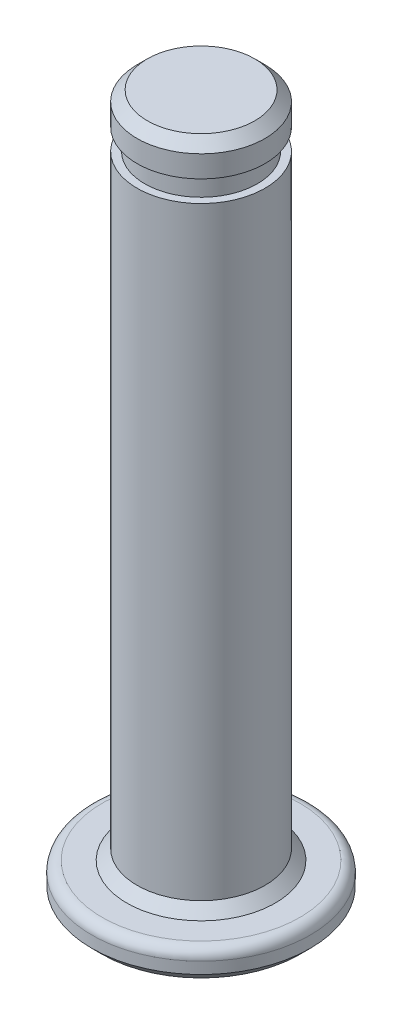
SolidWorks part; units mm, degrees
ref_plane "Front" through (0, 0, 0) normal (0, 0, 1) x (1, 0, 0)
ref_plane "Top" through (0, 0, 0) normal (0, 1, 0) x (1, 0, 0)
ref_plane "Right" through (0, 0, 0) normal (1, 0, 0) x (0, 0, -1)
sketch "Sketch1" plane through (0, 0, 0) normal (0, 0, 1) x (1, 0, 0)
  line L0 (0, 0) -> (0, 126.1546) construction
  line L1 (-4.7625, 89.3482) -> (4.7625, 89.3482)
  line L2 (4.7625, 89.3482) -> (4.7625, 86.9669)
  line L3 (-4.7625, 89.3482) -> (-4.7625, 86.9669)
  line L4 (4.7625, 86.9669) -> (4.191, 86.9669)
  line L5 (-4.7625, 86.9669) -> (-4.191, 86.9669)
  line L6 (4.191, 86.9669) -> (4.191, 85.3794)
  line L7 (-4.191, 86.9669) -> (-4.191, 85.3794)
  line L8 (4.191, 85.3794) -> (4.7625, 85.3794)
  line L9 (-4.191, 85.3794) -> (-4.7625, 85.3794)
  line L10 (4.7625, 85.3794) -> (4.7625, 39.6594)
  line L11 (-4.7625, 85.3794) -> (-4.7625, 39.6594)
  line L12 (4.7625, 39.6594) -> (8.128, 39.6594)
  line L13 (-4.7625, 39.6594) -> (-8.128, 39.6594)
  line L14 (8.128, 39.6594) -> (8.128, 37.2782)
  line L15 (-8.128, 39.6594) -> (-8.128, 37.2782)
  line L16 (8.128, 37.2782) -> (-8.128, 37.2782)
  point P6 (0, 89.3482)
  point P21 (0, 37.2782)
  dimension "D1" = 9.525
  dimension "D2" = 16.256
  dimension "D3" = 8.382
  dimension "D4" = 9.525
  dimension "D5" = 2.3813
  dimension "D6" = 45.72
  dimension "D7" = 1.5875
  dimension "D8" = 2.3813
revolve "Revolve2" add sketch "Sketch1" angle 360 about L0
chamfer "Chamfer1" distance 0.762 angle 45 1 edges at (0, 89.3482, -4.7625)
chamfer "Chamfer2" distance 0.762 angle 45 1 edges at (0, 39.6594, -4.7625)
chamfer "Chamfer3" distance 0.762 angle 45 1 edges at (0, 37.2782, -8.128)
fillet "Fillet1" radius 0.762 1 edges at (0, 39.6594, -8.128)
